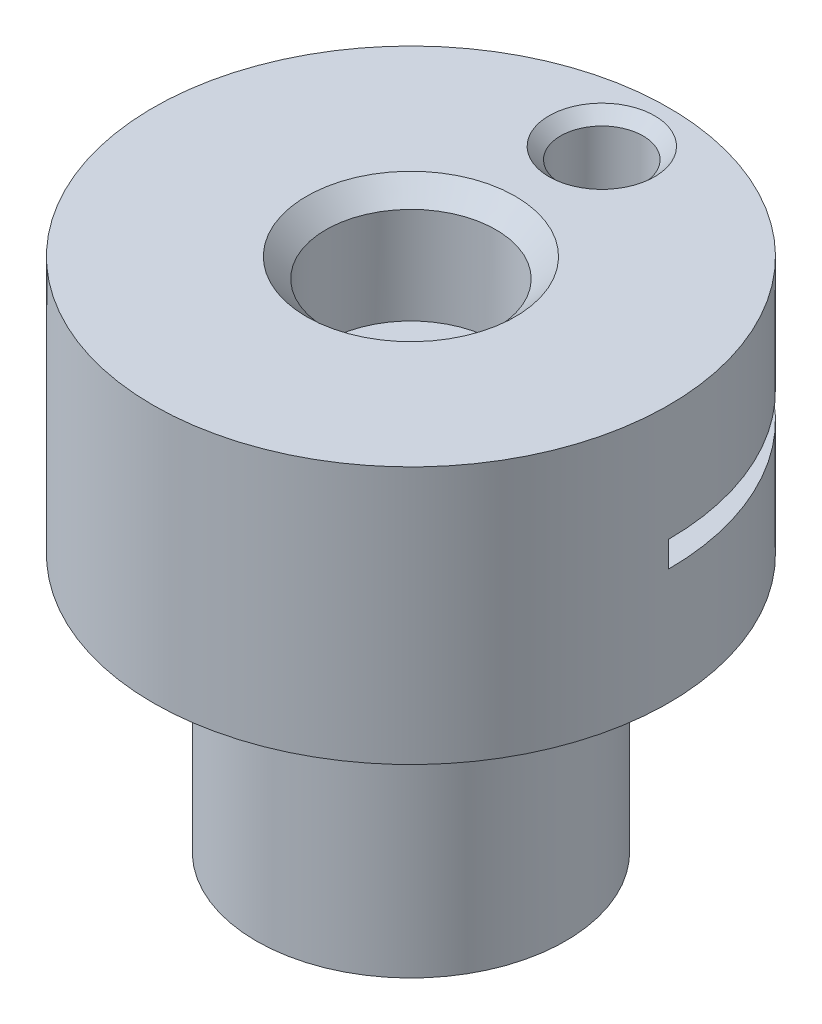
SolidWorks part; units mm, degrees
ref_plane "前视基准面" through (0, 0, 0) normal (0, 0, 1) x (1, 0, 0)
ref_plane "上视基准面" through (0, 0, 0) normal (0, 1, 0) x (1, 0, 0)
ref_plane "右视基准面" through (0, 0, 0) normal (1, 0, 0) x (0, 0, -1)
other "Configuration Table"
sketch "草图1" plane through (0, 0, 0) normal (0, 0, 1) x (1, 0, 0)
  line L0 (0, 0) -> (-3, 0)
  line L1 (-3, 0) -> (-3, 5)
  line L2 (-3, 5) -> (-5, 5)
  line L3 (-5, 5) -> (-5, 10)
  line L4 (-5, 10) -> (0, 10)
  line L5 (0, 12.8086) -> (0, -4.306) construction
  line L6 (0, 0) -> (0, 10)
  point P9 (0, 10)
  dimension "D1" = 6
  dimension "D2" = 10
  dimension "D3" = 5
  dimension "D4" = 5
revolve "旋转1" add sketch "草图1" angle 360 about L5
hole_wizard "M4 螺纹孔1" positions "3D草图1" profile "草图2" tap size "M4" standard "GB"
sketch3d "3D草图1"
  point P0 (0.0003, 10, 0.0002)
sketch "草图2" plane through (0.0003, 10, 0.0002) normal (1, 0, 0) x (0, 0, 1)
  line L0 (0, 0) -> (0, 10)
  line L1 (0, 10) -> (1.65, 10)
  line L2 (1.65, 10) -> (1.65, 0.375)
  line L3 (1.65, 0.375) -> (2.025, 0)
  line L5 (2.025, 0) -> (0, 0)
  line L6 (-1.65, 0.375) -> (-2.025, 0) construction
  line L11 (0, -6.35) -> (0, 107.95) construction
  dimension "通孔螺纹孔钻头直径" = 3.3
  dimension "通孔螺纹孔钻头深度" = 10
  dimension "近端锥形沉头孔直径" = 4.05
  dimension "近端锥形沉头孔角度" = 90
sketch "草图3" plane through (0, 10, 0) normal (0, 1, 0) x (1, 0, 0)
  line L1 (0, 5) -> (0.0003, 2.0248) construction
  circle A3 centre (0, 0) radius 5 construction
  circle A4 centre (0.0003, -0.0002) radius 2.025 construction
  circle A5 centre (0.0001, 3.7026) radius 0.685
  point P22 (0.0001, 3.7026)
  point P30 (0, 0)
  point P31 (0, 0)
  point P32 (0.0001, 3.7026)
hole_wizard "M2 螺纹孔1" positions "草图3" profile "草图4" tap size "M2" standard "GB"
sketch "草图4" plane through (0.0001, 10, -3.7026) normal (1, 0, 0) x (0, 0, 1)
  line L0 (0, 0) -> (0, 5)
  line L1 (0, 5) -> (0.8, 5)
  line L2 (0.8, 5) -> (0.8, 0.225)
  line L3 (0.8, 0.225) -> (1.025, 0)
  line L5 (1.025, 0) -> (0, 0)
  line L6 (-0.8, 0.225) -> (-1.025, 0) construction
  line L11 (0, -6.35) -> (0, 107.95) construction
  dimension "通孔螺纹孔钻头直径" = 1.6
  dimension "通孔螺纹孔钻头深度" = 5
  dimension "近端锥形沉头孔直径" = 2.05
  dimension "近端锥形沉头孔角度" = 90
sketch "草图5" plane through (0, 0, 0) normal (0, 0, 1) x (1, 0, 0)
  line L0 (0, 5) -> (0.0003, 10) construction
  line L5 (-3, 5) -> (3, 5) construction
  line L6 (2.0253, 10) -> (-2.0247, 10) construction
  line L8 (7.0728, 7.25) -> (-7.0725, 7.25)
  line L9 (7.0728, 7.25) -> (7.0728, 7.75)
  line L10 (7.0728, 7.75) -> (-7.0725, 7.75)
  line L11 (-7.0725, 7.25) -> (-7.0725, 7.75)
  line L12 (7.0728, 7.25) -> (-7.0725, 7.75) construction
  line L13 (7.0728, 7.75) -> (-7.0725, 7.25) construction
  point P6 (0.0001, 7.5)
  dimension "D1" = 0.5
extrude "切除-拉伸1" cut sketch "草图5" against normal blind 10
